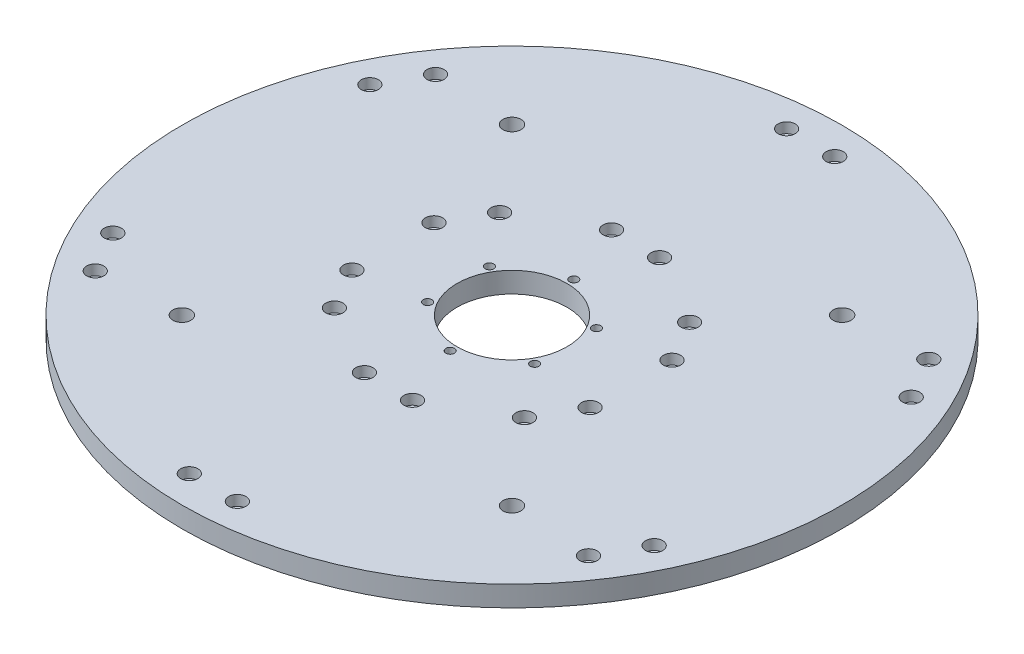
SolidWorks part; units mm, degrees
ref_plane "Front Plane" through (0, 0, 0) normal (0, 0, 1) x (1, 0, 0)
ref_plane "Top Plane" through (0, 0, 0) normal (0, 1, 0) x (1, 0, 0)
ref_plane "Right Plane" through (0, 0, 0) normal (1, 0, 0) x (0, 0, -1)
sketch "Sketch1" plane through (0, 0, 0) normal (0, 1, 0) x (1, 0, 0)
  circle A0 centre (0, 0) radius 304.8
  circle A1 centre (0, 0) radius 50.8
  dimension "D1" = 609.6
  dimension "D2" = 101.6
extrude "Extrude1" add sketch "Sketch1" along normal blind 19.05
hole_wizard "CBORE for 3/8 Socket Head Cap Screw1" positions "Sketch3" profile "Sketch2" counterbore size "3/8" standard "Example Inch"
sketch "Sketch3" plane through (0, 19.05, 0) normal (0, 1, 0) x (-1, 0, 0)
  line L0 (0, 0) -> (0, 216.727) construction
  line L1 (-30.4169, 195.2625) -> (22.225, 195.2625) construction
  point P0 (-22.225, 114.3)
  point P1 (22.225, 276.225)
  point P3 (-22.225, 276.225)
  point P5 (22.225, 114.3)
  dimension "D1" = 161.925
  dimension "D2" = 44.45
  dimension "D3" = 114.3
sketch "Sketch2" plane through (22.225, 19.05, 114.3) normal (1, 0, 0) x (0, 0, 1)
  line L0 (0, 0) -> (0, 19.05)
  line L1 (0, 19.05) -> (5.0419, 19.05)
  line L3 (5.0419, 19.05) -> (5.0419, 9.525)
  line L4 (5.0419, 9.525) -> (7.9375, 9.525)
  line L5 (7.9375, 9.525) -> (7.9375, 0)
  line L7 (7.9375, 0) -> (0, 0)
  line L11 (0, -6.35) -> (0, 107.95) construction
  dimension "Thru Hole Dia." = 10.0838
  dimension "Thru Hole Depth" = 19.05
  dimension "C'Bore Dia." = 15.875
  dimension "C'Bore Depth" = 9.525
pattern_circular "CirPattern1" count 6 over 360 about axis through (0, 0, 0) along (0, 1, 0) of "CBORE for 3/8 Socket Head Cap Screw1"
hole_wizard "5/8 Clearance Hole1" positions "Sketch5" profile "Sketch4" hole size "5/8" standard "Example Inch"
sketch "Sketch5" plane through (0, 19.05, 0) normal (0, 1, 0) x (-1, 0, 0)
  line L1 (0, 0) -> (152.6644, -152.6644) construction
  line L3 (0, -215.9) -> (215.9, 0) construction
  circle A0 centre (0, 0) radius 215.9 construction
  point P0 (152.6644, -152.6644)
  dimension "D1" = 431.8
sketch "Sketch4" plane through (-152.6644, 19.05, -152.6644) normal (1, 0, 0) x (0, 0, 1)
  line L0 (0, 0) -> (0, 19.05)
  line L1 (0, 19.05) -> (8.3337, 19.05)
  line L2 (8.3337, 19.05) -> (8.3337, 0)
  line L5 (8.3337, 0) -> (0, 0)
  line L11 (0, -6.35) -> (0, 107.95) construction
  dimension "Thru Hole Dia." = 16.6675
  dimension "Thru Hole Depth" = 19.05
pattern_circular "CirPattern2" count 4 over 360 about axis through (0, 0, 0) along (0, 1, 0) of "5/8 Clearance Hole1"
hole_wizard "5/16 (0.3125) Diameter Hole1" positions "Sketch7" profile "Sketch6" hole size "5/16" standard "Example Inch"
sketch "Sketch7" plane through (0, 19.05, 0) normal (0, 1, 0) x (-1, 0, 0)
  line L0 (0, 0) -> (0, -57.15) construction
  line L1 (0, 0) -> (-49.4934, -28.575) construction
  point P0 (0, -57.15)
  point P13 (-49.4934, -28.575)
  point P14 (-49.4934, 28.575)
  point P15 (0, 57.15)
  point P16 (49.4934, 28.575)
  point P17 (49.4934, -28.575)
  dimension "D2" = 60
  dimension "D3" = 57.15
sketch "Sketch6" plane through (0, 19.05, -57.15) normal (1, 0, 0) x (0, 0, 1)
  line L0 (0, 0) -> (0, 19.05)
  line L1 (0, 19.05) -> (3.9687, 19.05)
  line L2 (3.9687, 19.05) -> (3.9687, 0)
  line L5 (3.9687, 0) -> (0, 0)
  line L11 (0, -6.35) -> (0, 107.95) construction
  dimension "Thru Hole Dia." = 7.9375
  dimension "Thru Hole Depth" = 19.05
